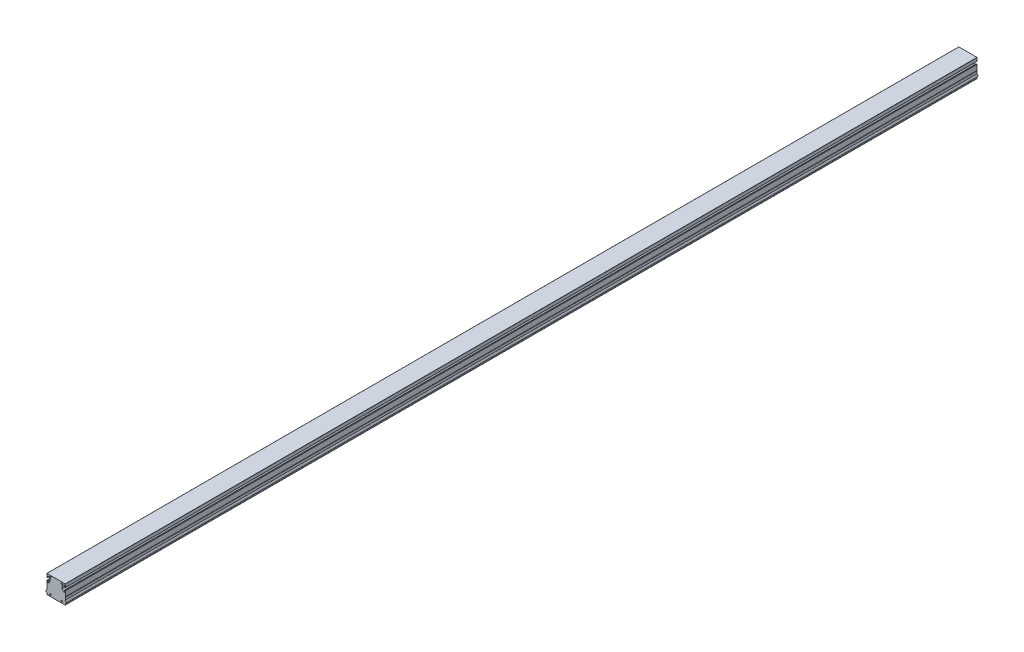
SolidWorks part; units mm, degrees
ref_plane "Ebene vorne" through (0, 0, 0) normal (0, 0, 1) x (1, 0, 0)
ref_plane "Ebene oben" through (0, 0, 0) normal (0, 1, 0) x (1, 0, 0)
ref_plane "Ebene rechts" through (0, 0, 0) normal (1, 0, 0) x (0, 0, -1)
sketch "Aussen" plane through (0, 0, 0) normal (0, 0, 1) x (1, 0, 0)
  line L4 (30, -30) -> (30, 30)
  line L5 (-30, 30) -> (-30, -30)
  line L6 (30, 30) -> (-30, 30)
  line L7 (30, -30) -> (-30, -30)
  point P3 (0, 30)
  point P4 (-30, 0)
  dimension "D1" = 60
  dimension "D2" = 60
extrude "Linear austragen1" add sketch "Aussen" along normal blind 2870
sketch "Markierung" plane through (0, 0, 0) normal (0, 0, 1) x (1, 0, 0)
  line L0 (30, -30) -> (30, 30) construction
  line L1 (30, -7.6) -> (30, -6.4)
  line L2 (-30, -30) -> (30, -30) construction
  arc A1 (30, -6.4) -> (30, -7.6) centre (30, -7) ccw
  dimension "D1" = 0.6
  dimension "D2" = 23
extrude "Schnitt-Linear austragen2" cut sketch "Markierung" along normal through all
sketch "Führung" plane through (0, 0, 0) normal (0, 0, 1) x (1, 0, 0)
  line L0 (30, -30) -> (30, -7.6) construction
  line L1 (-30, -30) -> (30, -30) construction
  line L2 (30, -25.1958) -> (30, -16.2042)
  arc A1 (30, -16.2042) -> (30, -25.1958) centre (27.7, -20.7) ccw
  dimension "D1" = 5.05
  dimension "D2" = 2.3
  dimension "D3" = 9.3
extrude "Schnitt-Linear austragen3" cut sketch "Führung" along normal through all
sketch "NUT" plane through (0, 0, 0) normal (0, 0, 1) x (1, 0, 0)
  line L0 (30, -6.4) -> (30, 30) construction
  line L1 (30, 10.95) -> (30, 19.05)
  line L7 (30, 10.95) -> (27, 10.95)
  line L8 (27, 10.95) -> (27, 3.7929)
  line L9 (27, 3.7929) -> (19.2, 11.5929)
  line L10 (19.2, 11.5929) -> (19.2, 18.4071)
  line L11 (19.2, 18.4071) -> (27, 26.2071)
  line L12 (27, 26.2071) -> (27, 19.05)
  line L13 (27, 19.05) -> (30, 19.05)
  dimension "D1" = 19.2
  dimension "D2" = 7.8
  dimension "D3" = 26.2071
  dimension "D4" = 3.7929
  dimension "D5" = 7.1571
extrude "Schnitt-Linear austragen4" cut sketch "NUT" along normal through all
mirror "Spiegeln2" about plane through (0, 0, 0) normal (1, 0, 0) of "Schnitt-Linear austragen4", "Schnitt-Linear austragen3", "Schnitt-Linear austragen2"
fillet "Verrundung1" radius 0.5 16 edges at (30, 19.05, 1435) (30, 10.95, 1435) (27, 3.7929, 1435) (27, 10.95, 1435) (27, 26.2071, 1435) (27, 19.05, 1435) (30, -30, 1435) (30, 30, 1435) (-30, -30, 1435) (-27, 3.7929, 1435) (-27, 10.95, 1435) (-30, 10.95, 1435) (-30, 30, 1435) (-30, 19.05, 1435) (-27, 19.05, 1435) (-27, 26.2071, 1435)
fillet "Verrundung2" radius 0.3 4 edges at (30, -16.2042, 1435) (30, -25.1958, 1435) (-30, -25.1958, 1435) (-30, -16.2042, 1435)
hole_wizard "Ø4.9 (4.9) Durchmesser Bohrung1" positions "Skizze7" profile "Skizze8" hole size "Ø4.9" standard "DIN"
sketch "Skizze7" plane through (0, 0, 0) normal (0, 0, -1) x (-1, 0, 0)
  line L1 (-29.5, 30) -> (29.5, 30) construction
  line L2 (30, 29.5) -> (30, 19.55) construction
  line L3 (-30, 19.55) -> (-30, 29.5) construction
  line L4 (-30, -29.5) -> (-30, -25.6621) construction
  point P0 (-18.5, 24.5)
  point P5 (18.5, 24.5)
  point P8 (-18.5, -24.5)
  point P11 (18.5, -24.5)
  dimension "D1" = 37
  dimension "D2" = 49
  dimension "D3" = 37
  dimension "D4" = 49
  dimension "D5" = 5.5
  dimension "D6" = 11.5
  dimension "D7" = 11.5
  dimension "D8" = 11.5
sketch "Skizze8" plane through (18.5, 24.5, 0) normal (1, 0, 0) x (0, 1, 0)
  line L0 (0, 0) -> (0, 2870)
  line L1 (0, 2870) -> (2.45, 2870)
  line L2 (2.45, 2870) -> (2.45, 0)
  line L5 (2.45, 0) -> (0, 0)
  line L11 (0, -6.35) -> (0, 107.95) construction
  dimension "Bohrerdurchmesser" = 4.9
  dimension "Bohrungstiefe" = 2870
sketch "Skizze9" plane through (0, 0, 2870) normal (0, 0, 1) x (1, 0, 0)
  circle A0 centre (-27.7, -20.7) radius 5.05
  circle A1 centre (27.7, -20.7) radius 5.05
  dimension "D1" = 10.1
  dimension "D2" = 10.1
extrude "Linear austragen2" add sketch "Skizze9" against normal up to surface (2870 mm away)
